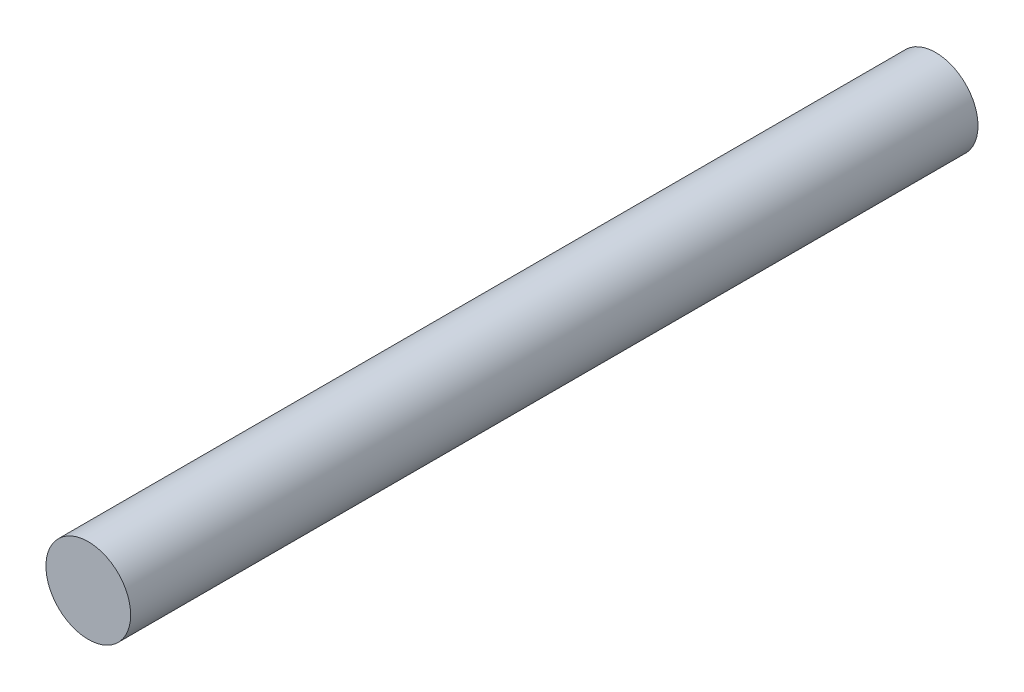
SolidWorks part; units mm, degrees
ref_plane "Plan de face" through (0, 0, 0) normal (0, 0, 1) x (1, 0, 0)
ref_plane "Plan de dessus" through (0, 0, 0) normal (0, 1, 0) x (1, 0, 0)
ref_plane "Plan de droite" through (0, 0, 0) normal (1, 0, 0) x (0, 0, -1)
sketch "Esquisse1" plane through (0, 0, 0) normal (0, 0, 1) x (1, 0, 0)
  circle A0 centre (0, 0) radius 0.5
extrude "Boss.-Extru.1" add sketch "Esquisse1" along normal blind 10
